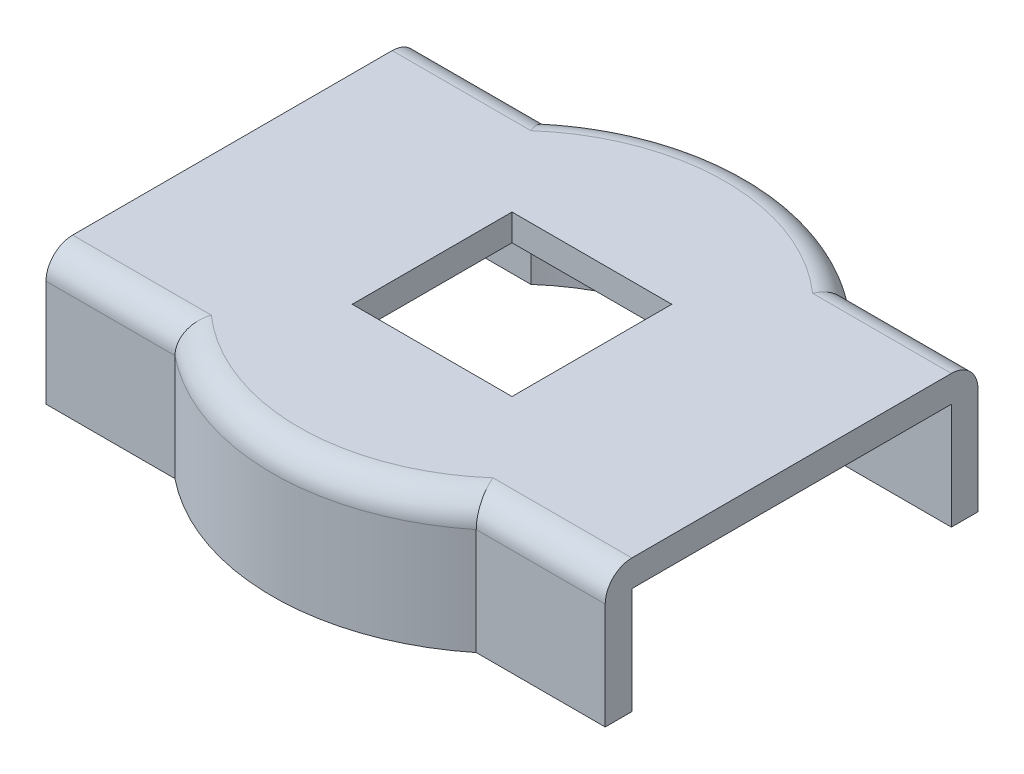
SolidWorks part; units mm, degrees
ref_plane "Front" through (0, 0, 0) normal (0, 0, 1) x (1, 0, 0)
ref_plane "Top" through (0, 0, 0) normal (0, 1, 0) x (1, 0, 0)
ref_plane "Right" through (0, 0, 0) normal (1, 0, 0) x (0, 0, -1)
sketch "Sketch1" plane through (0, 0, 0) normal (0, 1, 0) x (1, 0, 0)
  line L0 (21, -14) -> (11.3137, -14)
  line L1 (0, 0) -> (-21, 0) construction
  line L2 (0, 0) -> (0, 18) construction
  line L3 (21, 14) -> (11.3137, 14)
  line L4 (-21, -14) -> (-21, 14)
  line L5 (21, -14) -> (21, 14)
  line L6 (-11.3137, 14) -> (-21, 14)
  line L7 (-11.3137, -14) -> (-21, -14)
  arc A0 (-11.3137, -14) -> (11.3137, -14) centre (0, 0) ccw
  arc A1 (11.3137, 14) -> (-11.3137, 14) centre (0, 0) ccw
  point P9 (0, -18)
  dimension "D2" = 18
  dimension "D1" = 28
  dimension "D3" = 42
extrude "Extrude1" add sketch "Sketch1" along normal blind 10
fillet "Fillet1" radius 2 6 edges at (-16.1569, 10, -14) (0, 10, -18) (16.1569, 10, -14) (16.1569, 10, 14) (0, 10, 18) (-16.1569, 10, 14)
sketch "Эскиз1" plane through (0, 10, 0) normal (0, 1, 0) x (1, 0, 0)
  line L0 (0, 6) -> (0, 0) construction
  line L1 (-6, 6) -> (6, 6)
  line L2 (-6, 6) -> (-6, -6)
  line L3 (-6, -6) -> (6, -6)
  line L4 (6, 6) -> (6, -6)
  line L5 (0, 0) -> (-6, 0) construction
  dimension "D1" = 12
extrude "Вытянуть1" cut sketch "Эскиз1" against normal through all
shell "Оболочка1" thickness 2
